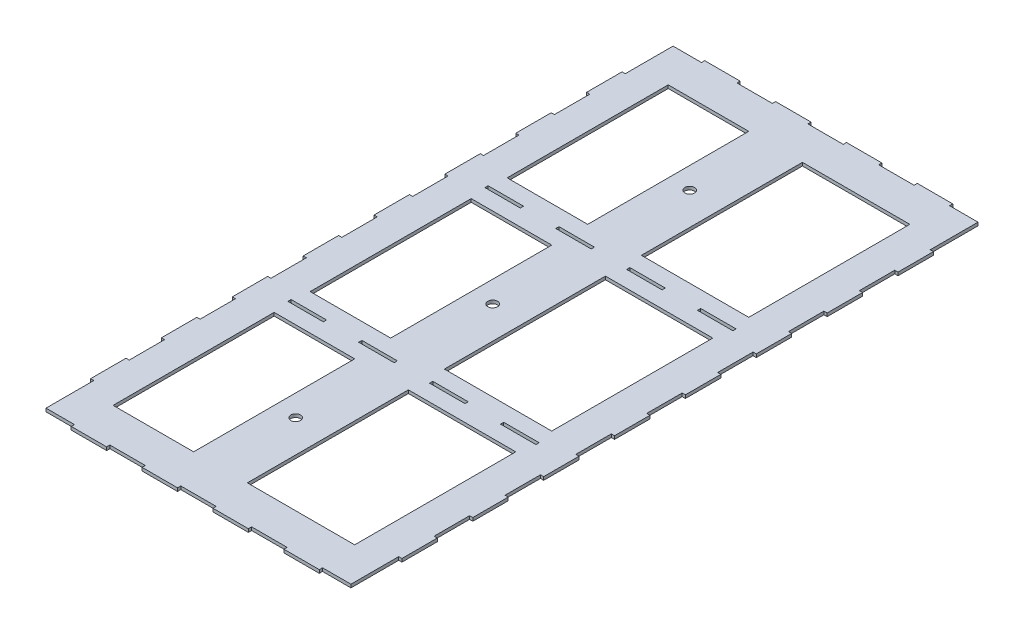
SolidWorks part; units mm, degrees
ref_plane "Front Plane" through (0, 0, 0) normal (0, 0, 1) x (1, 0, 0)
ref_plane "Top Plane" through (0, 0, 0) normal (0, 1, 0) x (1, 0, 0)
ref_plane "Right Plane" through (0, 0, 0) normal (1, 0, 0) x (0, 0, -1)
sketch "Sketch1" plane through (0, 0, 0) normal (0, 1, 0) x (1, 0, 0)
  line L0 (889, 590) -> (889, 545.5)
  line L1 (889, 545.5) -> (886, 545.5)
  line L2 (886, 545.5) -> (886, 512.5)
  line L3 (886, 512.5) -> (889, 512.5)
  line L4 (889, 512.5) -> (889, 479.5)
  line L5 (889, 479.5) -> (886, 479.5)
  line L6 (886, 479.5) -> (886, 446.5)
  line L7 (886, 446.5) -> (889, 446.5)
  line L8 (889, 446.5) -> (889, 413.5)
  line L9 (889, 413.5) -> (886, 413.5)
  line L10 (886, 413.5) -> (886, 380.5)
  line L11 (886, 380.5) -> (889, 380.5)
  line L12 (889, 380.5) -> (889, 347.5)
  line L13 (889, 347.5) -> (886, 347.5)
  line L14 (886, 347.5) -> (886, 314.5)
  line L15 (886, 314.5) -> (889, 314.5)
  line L16 (889, 314.5) -> (889, 281.5)
  line L17 (889, 281.5) -> (886, 281.5)
  line L18 (886, 281.5) -> (886, 248.5)
  line L19 (886, 248.5) -> (889, 248.5)
  line L20 (889, 248.5) -> (889, 215.5)
  line L21 (889, 215.5) -> (886, 215.5)
  line L22 (886, 215.5) -> (886, 182.5)
  line L23 (886, 182.5) -> (889, 182.5)
  line L24 (889, 182.5) -> (889, 149.5)
  line L25 (889, 149.5) -> (886, 149.5)
  line L26 (886, 149.5) -> (886, 116.5)
  line L27 (886, 116.5) -> (889, 116.5)
  line L28 (889, 116.5) -> (889, 83.5)
  line L29 (889, 83.5) -> (886, 83.5)
  line L30 (886, 83.5) -> (886, 50.5)
  line L31 (886, 50.5) -> (889, 50.5)
  line L32 (889, 50.5) -> (889, 17.5)
  line L33 (889, 17.5) -> (889, 6)
  line L34 (889, 6) -> (915.5, 6)
  line L35 (915.5, 6) -> (915.5, 3)
  line L36 (915.5, 3) -> (948.5, 3)
  line L37 (948.5, 3) -> (948.5, 6)
  line L38 (948.5, 6) -> (981.5, 6)
  line L39 (981.5, 6) -> (981.5, 3)
  line L40 (981.5, 3) -> (1014.5, 3)
  line L41 (1014.5, 3) -> (1014.5, 6)
  line L42 (1014.5, 6) -> (1047.5, 6)
  line L43 (1047.5, 6) -> (1047.5, 3)
  line L44 (1047.5, 3) -> (1080.5, 3)
  line L45 (1080.5, 3) -> (1080.5, 6)
  line L46 (1080.5, 6) -> (1113.5, 6)
  line L47 (1113.5, 6) -> (1113.5, 3)
  line L48 (1113.5, 3) -> (1146.5, 3)
  line L49 (1146.5, 3) -> (1146.5, 6)
  line L50 (1146.5, 6) -> (1173, 6)
  line L51 (1173, 6) -> (1173, 50.5)
  line L52 (1173, 50.5) -> (1176, 50.5)
  line L53 (1176, 50.5) -> (1176, 83.5)
  line L54 (1176, 83.5) -> (1173, 83.5)
  line L55 (1173, 83.5) -> (1173, 116.5)
  line L56 (1173, 116.5) -> (1176, 116.5)
  line L57 (1176, 116.5) -> (1176, 149.5)
  line L58 (1176, 149.5) -> (1173, 149.5)
  line L59 (1173, 149.5) -> (1173, 182.5)
  line L60 (1173, 182.5) -> (1176, 182.5)
  line L61 (1176, 182.5) -> (1176, 215.5)
  line L62 (1176, 215.5) -> (1173, 215.5)
  line L63 (1173, 215.5) -> (1173, 248.5)
  line L64 (1173, 248.5) -> (1176, 248.5)
  line L65 (1176, 248.5) -> (1176, 281.5)
  line L66 (1176, 281.5) -> (1173, 281.5)
  line L67 (1173, 281.5) -> (1173, 314.5)
  line L68 (1173, 314.5) -> (1176, 314.5)
  line L69 (1176, 314.5) -> (1176, 347.5)
  line L70 (1176, 347.5) -> (1173, 347.5)
  line L71 (1173, 347.5) -> (1173, 380.5)
  line L72 (1173, 380.5) -> (1176, 380.5)
  line L73 (1176, 380.5) -> (1176, 413.5)
  line L74 (1176, 413.5) -> (1173, 413.5)
  line L75 (1173, 413.5) -> (1173, 446.5)
  line L76 (1173, 446.5) -> (1176, 446.5)
  line L77 (1176, 446.5) -> (1176, 479.5)
  line L78 (1176, 479.5) -> (1173, 479.5)
  line L79 (1173, 479.5) -> (1173, 512.5)
  line L80 (1173, 512.5) -> (1176, 512.5)
  line L81 (1176, 512.5) -> (1176, 545.5)
  line L82 (1176, 545.5) -> (1173, 545.5)
  line L83 (1173, 545.5) -> (1173, 578.5)
  line L84 (1173, 578.5) -> (1173, 590)
  line L85 (1173, 590) -> (1146.5, 590)
  line L86 (1146.5, 590) -> (1146.5, 593)
  line L87 (1146.5, 593) -> (1113.5, 593)
  line L88 (1113.5, 593) -> (1113.5, 590)
  line L89 (1113.5, 590) -> (1080.5, 590)
  line L90 (1080.5, 590) -> (1080.5, 593)
  line L91 (1080.5, 593) -> (1047.5, 593)
  line L92 (1047.5, 593) -> (1047.5, 590)
  line L93 (1047.5, 590) -> (1014.5, 590)
  line L94 (1014.5, 590) -> (1014.5, 593)
  line L95 (1014.5, 593) -> (981.5, 593)
  line L96 (981.5, 593) -> (981.5, 590)
  line L97 (981.5, 590) -> (948.5, 590)
  line L98 (948.5, 590) -> (948.5, 593)
  line L99 (948.5, 593) -> (915.5, 593)
  line L100 (915.5, 593) -> (915.5, 590)
  line L101 (915.5, 590) -> (889, 590)
  line L102 (915.5, 207.75) -> (948.5, 207.75)
  line L103 (1043, 556.5) -> (1143, 556.5)
  line L104 (1043, 556.5) -> (1043, 406.5)
  line L105 (1043, 406.5) -> (1143, 406.5)
  line L106 (1143, 556.5) -> (1143, 406.5)
  line L107 (1043, 373) -> (1143, 373)
  line L108 (1043, 373) -> (1043, 223)
  line L109 (1043, 223) -> (1143, 223)
  line L110 (1143, 373) -> (1143, 223)
  line L111 (1043, 189.5) -> (1143, 189.5)
  line L112 (1043, 189.5) -> (1043, 39.5)
  line L113 (1043, 39.5) -> (1143, 39.5)
  line L114 (1143, 189.5) -> (1143, 39.5)
  line L115 (918, 556.5) -> (993, 556.5)
  line L116 (918, 556.5) -> (918, 406.5)
  line L117 (918, 406.5) -> (993, 406.5)
  line L118 (993, 556.5) -> (993, 406.5)
  line L119 (918, 373) -> (993, 373)
  line L120 (918, 373) -> (918, 223)
  line L121 (918, 223) -> (993, 223)
  line L122 (993, 373) -> (993, 223)
  line L123 (918, 189.5) -> (993, 189.5)
  line L124 (918, 189.5) -> (918, 39.5)
  line L125 (918, 39.5) -> (993, 39.5)
  line L126 (993, 189.5) -> (993, 39.5)
  line L127 (915.5, 391.25) -> (948.5, 391.25)
  line L128 (915.5, 391.25) -> (915.5, 388.25)
  line L129 (915.5, 388.25) -> (948.5, 388.25)
  line L130 (948.5, 391.25) -> (948.5, 388.25)
  line L131 (981.5, 391.25) -> (1014.5, 391.25)
  line L132 (981.5, 391.25) -> (981.5, 388.25)
  line L133 (981.5, 388.25) -> (1014.5, 388.25)
  line L134 (1014.5, 391.25) -> (1014.5, 388.25)
  line L135 (1047.5, 391.25) -> (1080.5, 391.25)
  line L136 (1047.5, 391.25) -> (1047.5, 388.25)
  line L137 (1047.5, 388.25) -> (1080.5, 388.25)
  line L138 (1080.5, 391.25) -> (1080.5, 388.25)
  line L139 (1113.5, 391.25) -> (1146.5, 391.25)
  line L140 (1113.5, 391.25) -> (1113.5, 388.25)
  line L141 (1113.5, 388.25) -> (1146.5, 388.25)
  line L142 (1146.5, 391.25) -> (1146.5, 388.25)
  line L143 (915.5, 207.75) -> (915.5, 204.75)
  line L144 (915.5, 204.75) -> (948.5, 204.75)
  line L145 (948.5, 207.75) -> (948.5, 204.75)
  line L146 (981.5, 207.75) -> (1014.5, 207.75)
  line L147 (981.5, 207.75) -> (981.5, 204.75)
  line L148 (981.5, 204.75) -> (1014.5, 204.75)
  line L149 (1014.5, 207.75) -> (1014.5, 204.75)
  line L150 (1047.5, 207.75) -> (1080.5, 207.75)
  line L151 (1047.5, 207.75) -> (1047.5, 204.75)
  line L152 (1047.5, 204.75) -> (1080.5, 204.75)
  line L153 (1080.5, 207.75) -> (1080.5, 204.75)
  line L154 (1113.5, 207.75) -> (1146.5, 207.75)
  line L155 (1113.5, 207.75) -> (1113.5, 204.75)
  line L156 (1113.5, 204.75) -> (1146.5, 204.75)
  line L157 (1146.5, 207.75) -> (1146.5, 204.75)
  circle A0 centre (1013, 481.5) radius 4.5
  circle A1 centre (1013, 298) radius 4.5
  circle A2 centre (1013, 114.5) radius 4.5
  dimension "D19" = 9
  dimension "D22" = 9
  dimension "D25" = 9
  dimension "D27" = 75
  dimension "D1" = 886
  dimension "D2" = 889
  dimension "D3" = 915.5
  dimension "D4" = 948.5
  dimension "D5" = 3
  dimension "D6" = 17.5
  dimension "D7" = 150
  dimension "D8" = 100
  dimension "D9" = 33.5
  dimension "D10" = 30
  dimension "D11" = 30
  dimension "D12" = 33.5
  dimension "D13" = 150
  dimension "D14" = 100
  dimension "D15" = 150
  dimension "D16" = 33.5
  dimension "D17" = 30
  dimension "D18" = 100
  dimension "D20" = 30
  dimension "D21" = 75
  dimension "D23" = 30
  dimension "D24" = 75
  dimension "D26" = 30
  dimension "D28" = 75
  dimension "D29" = 150
  dimension "D30" = 50
  dimension "D31" = 33.5
  dimension "D32" = 75
  dimension "D33" = 33.5
  dimension "D34" = 50
  dimension "D35" = 150
  dimension "D36" = 150
  dimension "D37" = 75
  dimension "D38" = 50
  dimension "D39" = 33.5
  dimension "D40" = 3
  dimension "D41" = 3
  dimension "D42" = 3
  dimension "D43" = 3
  dimension "D44" = 33
  dimension "D45" = 33
  dimension "D46" = 33
  dimension "D47" = 33
  dimension "D48" = 33
  dimension "D49" = 33
  dimension "D50" = 15.25
  dimension "D51" = 15.25
  dimension "D52" = 15.25
  dimension "D53" = 15.25
  dimension "D54" = 33
  dimension "D55" = 26.5
  dimension "D56" = 33
  dimension "D57" = 33
  dimension "D58" = 33
  dimension "D59" = 33
  dimension "D60" = 33
  dimension "D61" = 33
  dimension "D62" = 3
  dimension "D63" = 3
  dimension "D64" = 3
  dimension "D65" = 3
  dimension "D66" = 26.5
  dimension "D67" = 15.25
  dimension "D68" = 15.25
  dimension "D69" = 15.25
  dimension "D70" = 15.25
  dimension "D71" = 33
extrude "Boss-Extrude1" add sketch "Sketch1" along normal blind 3
